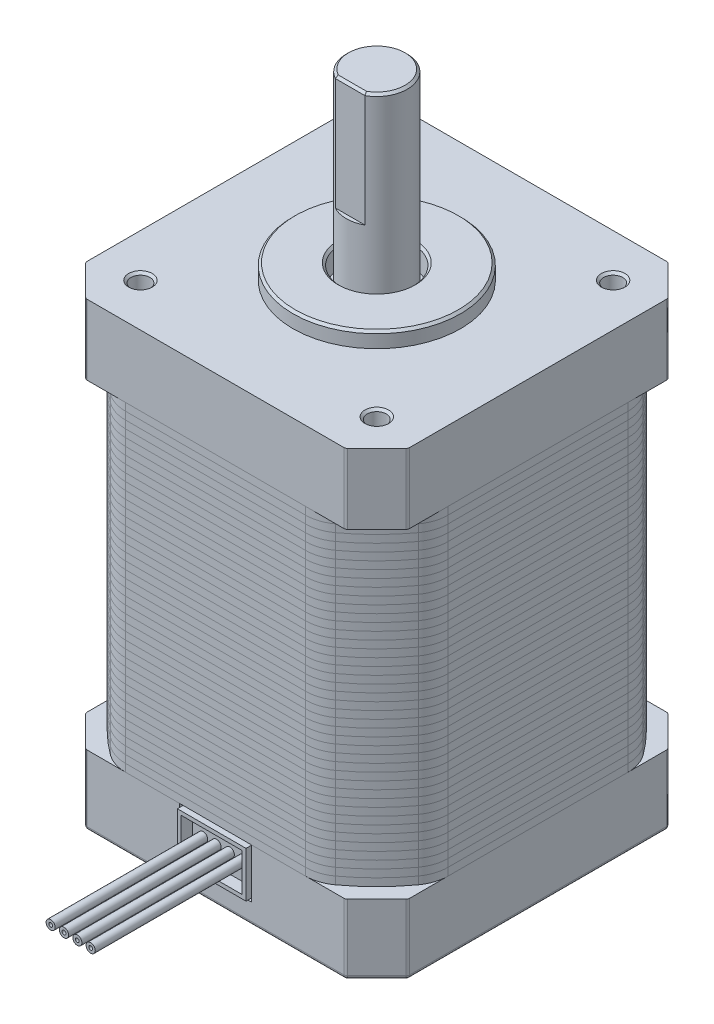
SolidWorks part; units mm, degrees
ref_plane "Спереди" through (0, 0, 0) normal (0, 0, 1) x (1, 0, 0)
ref_plane "Сверху" through (0, 0, 0) normal (0, 1, 0) x (1, 0, 0)
ref_plane "Справа" through (0, 0, 0) normal (1, 0, 0) x (0, 0, -1)
sketch "Эскиз1" plane through (0, 0, 0) normal (0, 1, 0) x (1, 0, 0)
  line L0 (-21.15, 17.0338) -> (-17.0338, 21.15)
  line L1 (-21.15, 21.15) -> (21.15, 21.15)
  line L2 (-21.15, 21.15) -> (-21.15, -21.15)
  line L3 (-21.15, -21.15) -> (21.15, -21.15)
  line L4 (21.15, 21.15) -> (21.15, -21.15)
  line L5 (-21.15, 21.15) -> (21.15, -21.15) construction
  line L6 (-21.15, -21.15) -> (21.15, 21.15) construction
  line L7 (-17.0338, 21.15) -> (17.0338, 21.15)
  line L8 (17.0338, 21.15) -> (21.15, 17.0338)
  line L9 (21.15, 17.0338) -> (21.15, -17.0338)
  line L10 (21.15, -17.0338) -> (17.0338, -21.15)
  line L11 (17.0338, -21.15) -> (-17.0338, -21.15)
  line L12 (-17.0338, -21.15) -> (-21.15, -17.0338)
  point P0 (0, 0)
  dimension "D1" = 42.3
  dimension "D2" = 54
extrude "Бобышка-Вытянуть1" add sketch "Эскиз1" along normal blind 9.2 contours L12 L3 L10 L4 L8 L1 L0 L2
sketch "Эскиз2" plane through (0, 9.2, 0) normal (0, 1, 0) x (1, 0, 0)
  line L0 (0, 21.15) -> (0, -21.15) construction
  line L1 (-21.15, 0) -> (21.15, 0) construction
  line L2 (-17.0338, 21.15) -> (17.0338, 21.15) construction
  line L3 (21.15, 17.0338) -> (21.15, -17.0338) construction
  line L25 (-11.7974, -21.15) -> (11.7974, -21.15)
  line L27 (21.15, -11.7974) -> (21.15, 11.7974)
  line L29 (11.7974, 21.15) -> (-11.7974, 21.15)
  line L31 (-21.15, 11.7974) -> (-21.15, -11.7974)
  arc A0 (-20.1875, -14.7467) -> (-14.7467, -20.1875) centre (0, 0) ccw
  arc A1 (-14.7467, 20.1875) -> (-20.1875, 14.7467) centre (0, 0) ccw
  arc A2 (20.1875, 14.7467) -> (14.7467, 20.1875) centre (0, 0) ccw
  arc A3 (14.7467, -20.1875) -> (20.1875, -14.7467) centre (0, 0) ccw
  arc A4 (14.7467, 20.1875) -> (11.7974, 21.15) centre (11.7974, 16.15) ccw
  arc A5 (21.15, 11.7974) -> (20.1875, 14.7467) centre (16.15, 11.7974) ccw
  arc A6 (20.1875, -14.7467) -> (21.15, -11.7974) centre (16.15, -11.7974) ccw
  arc A7 (11.7974, -21.15) -> (14.7467, -20.1875) centre (11.7974, -16.15) ccw
  arc A8 (-14.7467, -20.1875) -> (-11.7974, -21.15) centre (-11.7974, -16.15) ccw
  arc A9 (-20.1875, -14.7467) -> (-21.15, -11.7974) centre (-16.15, -11.7974) cw
  arc A10 (-20.1875, 14.7467) -> (-21.15, 11.7974) centre (-16.15, 11.7974) ccw
  arc A11 (-11.7974, 21.15) -> (-14.7467, 20.1875) centre (-11.7974, 16.15) ccw
  point P22 (21.15, 13.3296)
  point P27 (13.3296, -21.15)
  point P36 (-13.3296, 21.15)
  dimension "D1" = 50
  dimension "D3" = 5
extrude "Бобышка-Вытянуть3" add sketch "Эскиз2" along normal blind 1 separate body
sketch "Эскиз3" plane through (0, 0, 0) normal (0, -1, 0) x (1, 0, 0)
  circle A0 centre (0, 0) radius 4.75
  dimension "D1" = 9.5
extrude "Вырез-Вытянуть1" cut sketch "Эскиз3" against normal blind 3
sketch "Эскиз4" plane through (0, 3, 0) normal (0, -1, 0) x (1, 0, 0)
  circle A0 centre (0, 0) radius 2.5
  circle A1 centre (0, 0) radius 4.75
  dimension "D1" = 5
extrude "Вырез-Вытянуть2" cut sketch "Эскиз4" against normal blind 0.5
sketch "Эскиз5" plane through (0, 3, 0) normal (0, -1, 0) x (1, 0, 0)
  circle A0 centre (0, 0) radius 0.5
  dimension "D1" = 1
extrude "Вырез-Вытянуть3" cut sketch "Эскиз5" against normal blind 0.5
chamfer "Фаска1" distance 0.3 angle 45 1 edges at (0, 3, -2.5)
fillet "Скругление1" radius 0.5 17 edges at (0, 0, 21.15) (19.0919, 0, 19.0919) (21.15, 0, 0) (19.0919, 0, -19.0919) (0, 0, -21.15) (-19.0919, 0, -19.0919) (-21.15, 0, 0) (-19.0919, 0, 19.0919) (0, 0, -4.75) (21.15, 4.6, 17.0338) (17.0338, 4.6, 21.15) (-17.0338, 4.6, 21.15) (-21.15, 4.6, 17.0338) (-21.15, 4.6, -17.0338) (-17.0338, 4.6, -21.15) (17.0338, 4.6, -21.15) (21.15, 4.6, -17.0338)
sketch "Эскиз10" plane through (0, 0, 21.15) normal (0, 0, 1) x (1, 0, 0)
  line L0 (0, 0) -> (0, 9.2) construction
  line L1 (-11.7974, 9.2) -> (11.7974, 9.2) construction
  line L2 (-16.8267, 9.2) -> (16.8267, 9.2) construction
  line L3 (-4.75, 2.7) -> (4.75, 2.7)
  line L4 (-4.75, 2.7) -> (-4.75, 9.2)
  line L5 (-4.75, 9.2) -> (4.75, 9.2)
  line L6 (4.75, 2.7) -> (4.75, 9.2)
  line L7 (-4.75, 2.7) -> (4.75, 9.2) construction
  line L8 (-4.75, 9.2) -> (4.75, 2.7) construction
  point P5 (0, 5.95)
  dimension "D1" = 9.5
  dimension "D2" = 6.5
extrude "Вырез-Вытянуть6" cut sketch "Эскиз10" against normal blind 1
sketch "Эскиз11" plane through (0, 0, 20.15) normal (0, 0, 1) x (1, 0, 0)
  line L8 (4.5, 2.95) -> (4.5, 8.95)
  line L9 (4.5, 8.95) -> (-4.5, 8.95)
  line L10 (-4.5, 8.95) -> (-4.5, 2.95)
  line L11 (-4.5, 2.95) -> (4.5, 2.95)
  line L12 (4.5, 2.95) -> (4.5, 8.95)
  line L13 (4.5, 8.95) -> (-4.5, 8.95)
  line L14 (-4.5, 8.95) -> (-4.5, 2.95)
  line L15 (-4.5, 2.95) -> (4.5, 2.95)
  line L20 (4, 3.45) -> (4, 8.45)
  line L21 (4, 8.45) -> (-4, 8.45)
  line L22 (-4, 8.45) -> (-4, 3.45)
  line L23 (-4, 3.45) -> (4, 3.45)
  line L24 (4, 3.45) -> (4, 8.45)
  line L25 (4, 8.45) -> (-4, 8.45)
  line L26 (-4, 8.45) -> (-4, 3.45)
  line L27 (-4, 3.45) -> (4, 3.45)
  dimension "D1" = 0.25
  dimension "D2" = 0.75
extrude "Бобышка-Вытянуть6" add sketch "Эскиз11" along normal blind 1.5 separate body
sketch "Эскиз12" plane through (0, 0, 20.15) normal (0, 0, 1) x (1, 0, 0)
  line L0 (-4, 5.95) -> (4, 5.95) construction
  line L1 (-4, 8.45) -> (-4, 3.45) construction
  line L2 (4, 3.45) -> (4, 8.45) construction
  line L3 (-2.625, 5.95) -> (-2.625, 4.3362) construction
  line L4 (-2.625, 4.3362) -> (-0.875, 4.3362) construction
  line L5 (-0.875, 4.3362) -> (-0.875, 5.95) construction
  line L6 (-0.875, 5.95) -> (-0.875, 4.3362) construction
  line L7 (-0.875, 4.3362) -> (0.875, 4.3362) construction
  line L8 (0.875, 4.3362) -> (0.875, 5.95) construction
  line L9 (0.875, 5.95) -> (0.875, 4.3362) construction
  line L10 (0.875, 4.3362) -> (2.625, 4.3362) construction
  line L11 (2.625, 4.3362) -> (2.625, 5.95) construction
  line L12 (0, 5.95) -> (0, 4.3362) construction
  circle A0 centre (-2.625, 5.95) radius 0.6
  circle A1 centre (-0.875, 5.95) radius 0.6
  circle A2 centre (0.875, 5.95) radius 0.6
  circle A3 centre (2.625, 5.95) radius 0.6
  circle A4 centre (-2.625, 5.95) radius 0.25
  circle A5 centre (-0.875, 5.95) radius 0.25
  circle A6 centre (0.875, 5.95) radius 0.25
  circle A7 centre (2.625, 5.95) radius 0.25
  dimension "D1" = 1.2
  dimension "D2" = 0.5
  dimension "D3" = 1.75
extrude "Бобышка-Вытянуть7" add sketch "Эскиз12" along normal blind 15 separate body
extrude "Бобышка-Вытянуть8" add sketch "Эскиз12" along normal blind 20 separate body
pattern_linear "Линейный массив1" count 42 spacing 1 along (0, 1, 0) of "Бобышка-Вытянуть3"
ref_plane "Плоскость1" through (0, 51.2, 0) normal (0, 1, 0) x (1, 0, 0)
sketch "Эскиз19" plane through (0, 51.2, 0) normal (0, 1, 0) x (1, 0, 0)
  line L0 (-21.0036, 17.1802) -> (-17.1802, 21.0036) construction
  line L7 (-21.15, 16.8267) -> (-21.15, -16.8267) construction
  line L8 (16.8267, 21.15) -> (-16.8267, 21.15) construction
  line L10 (17.1802, 21.0036) -> (21.0036, 17.1802) construction
  line L16 (21.0036, -17.1802) -> (17.1802, -21.0036) construction
  line L18 (-17.1802, -21.0036) -> (-21.0036, -17.1802) construction
  line L20 (-16.8267, -21.15) -> (16.8267, -21.15) construction
  line L21 (21.15, -16.8267) -> (21.15, 16.8267) construction
  line L24 (-21.15, 17.0338) -> (-21.15, -17.0338)
  line L25 (-21.15, -17.0338) -> (-17.0338, -21.15)
  line L26 (-17.0338, -21.15) -> (17.0338, -21.15)
  line L27 (17.0338, -21.15) -> (21.15, -17.0338)
  line L28 (21.15, -17.0338) -> (21.15, 17.0338)
  line L29 (21.15, 17.0338) -> (17.0338, 21.15)
  line L30 (17.0338, 21.15) -> (-17.0338, 21.15)
  line L31 (-17.0338, 21.15) -> (-21.15, 17.0338)
extrude "Бобышка-Вытянуть15" add sketch "Эскиз19" along normal blind 9.2
sketch "Эскиз20" plane through (0, 60.4, 0) normal (0, 1, 0) x (1, 0, 0)
  line L1 (-15.5, 15.5) -> (15.5, 15.5) construction
  line L2 (-15.5, 15.5) -> (-15.5, -15.5) construction
  line L3 (-15.5, -15.5) -> (15.5, -15.5) construction
  line L4 (15.5, 15.5) -> (15.5, -15.5) construction
  line L5 (-15.5, 15.5) -> (15.5, -15.5) construction
  line L6 (-15.5, -15.5) -> (15.5, 15.5) construction
  circle A0 centre (-15.5, 15.5) radius 1.25
  circle A1 centre (15.5, 15.5) radius 1.25
  circle A2 centre (15.5, -15.5) radius 1.25
  circle A3 centre (-15.5, -15.5) radius 1.25
  point P0 (0, 0)
  dimension "D1" = 2.5
  dimension "D2" = 31
extrude "Вырез-Вытянуть7" cut sketch "Эскиз20" against normal blind 7
sketch "Эскиз21" plane through (0, 60.4, 0) normal (0, 1, 0) x (1, 0, 0)
  circle A0 centre (0, 0) radius 4.75
  dimension "D1" = 9.5
extrude "Вырез-Вытянуть8" cut sketch "Эскиз21" against normal blind 1
sketch "Эскиз22" plane through (0, 60.4, 0) normal (0, 1, 0) x (1, 0, 0)
  circle A0 centre (0, 0) radius 11
  circle A1 centre (0, 0) radius 4.75
  dimension "D1" = 22
  dimension "D2" = 9.5
extrude "Бобышка-Вытянуть16" add sketch "Эскиз22" along normal blind 2
fillet "Скругление2" radius 0.5 8 edges at (-17.0338, 55.8, -21.15) (-21.15, 55.8, -17.0338) (-21.15, 55.8, 17.0338) (-17.0338, 55.8, 21.15) (17.0338, 55.8, 21.15) (21.15, 55.8, 17.0338) (17.0338, 55.8, -21.15) (21.15, 55.8, -17.0338)
chamfer "Фаска2" distance 0.3 angle 45 6 edges at (15.5, 60.4, -14.25) (-15.5, 60.4, -14.25) (-15.5, 60.4, 16.75) (15.5, 60.4, 16.75) (0, 62.4, 4.75) (0, 62.4, 11)
sketch "Эскиз23" plane through (0, 59.4, 0) normal (0, 1, 0) x (1, 0, 0)
  circle A0 centre (0, 0) radius 4
  dimension "D1" = 8
extrude "Бобышка-Вытянуть17" add sketch "Эскиз23" along normal blind 25
sketch "Эскиз24" plane through (0, 84.4, 0) normal (0, 1, 0) x (1, 0, 0)
  line L0 (0, 4) -> (0, -4) construction
  line L1 (-1.9365, -3.5) -> (1.9365, -3.5)
  circle A0 centre (0, 0) radius 4 construction
  circle A1 centre (0, 0) radius 4 construction
  arc A2 (-1.9365, -3.5) -> (1.9365, -3.5) centre (0, 0) ccw
  dimension "D1" = 0.5
extrude "Вырез-Вытянуть9" cut sketch "Эскиз24" against normal blind 15
chamfer "Фаска3" distance 0.3 angle 45 2 edges at (0, 84.4, -4) (0, 84.4, 3.5)
